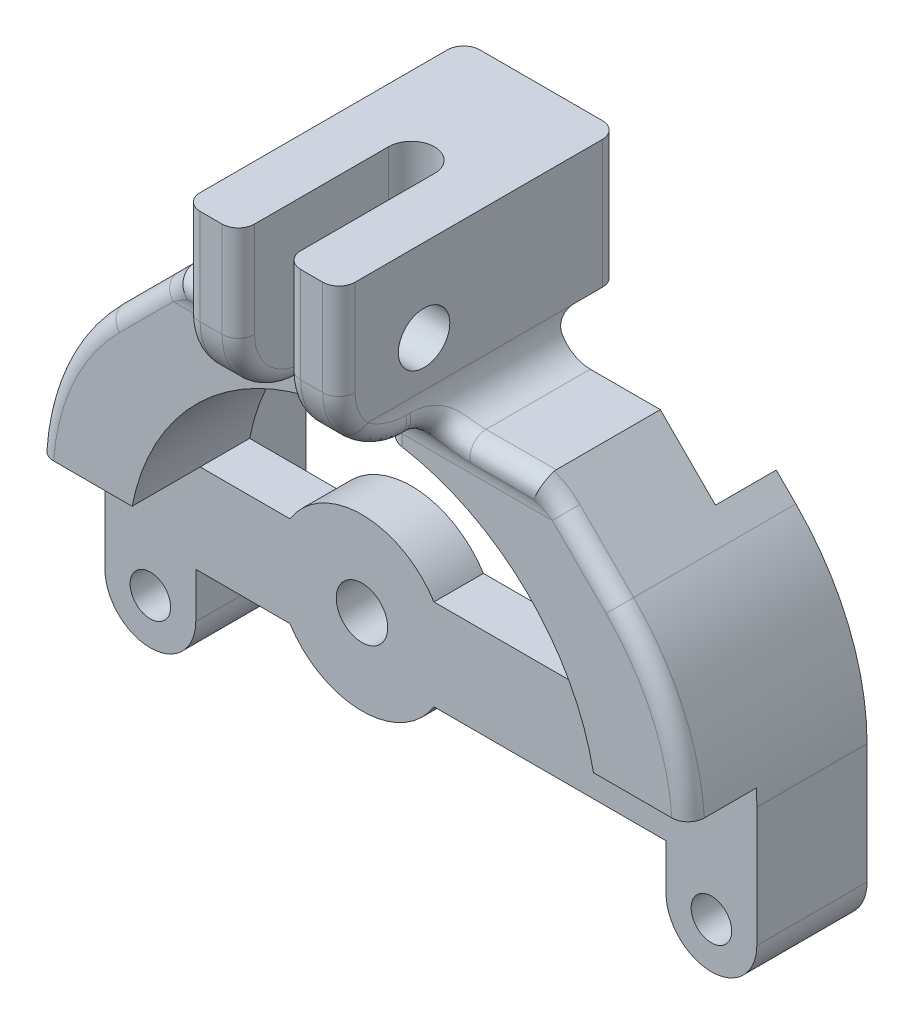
SolidWorks part; units mm, degrees
ref_plane "Front Plane" through (0, 0, 0) normal (0, 0, 1) x (1, 0, 0)
ref_plane "Top Plane" through (0, 0, 0) normal (0, 1, 0) x (1, 0, 0)
ref_plane "Right Plane" through (0, 0, 0) normal (1, 0, 0) x (0, 0, -1)
sketch "Sketch1" plane through (0, 0, 0) normal (0, 0, 1) x (1, 0, 0)
  line L0 (0, 0) -> (0, -52.1) construction
  line L1 (-17.3, 0) -> (17.3, 0) construction
  line L2 (-17.3, -9.6) -> (17.3, -9.6) construction
  line L3 (17.3, -9.6) -> (17.3, 0) construction
  line L4 (14.5, -9.6) -> (14.5, -4)
  line L5 (20.1, -9.6) -> (20.1, 13)
  line L6 (-17.3, -9.6) -> (-17.3, 0) construction
  line L7 (-20.1, -9.6) -> (-20.1, 13)
  line L8 (-14.5, -9.6) -> (-14.5, -4)
  line L9 (-17.3, 0) -> (-17.3, 9) construction
  line L10 (-20.1, 13) -> (20.1, 13)
  line L11 (-17.3, 9) -> (17.9065, 9) construction
  line L12 (3.3541, 9) -> (-3.3541, 9)
  line L13 (0, -4) -> (0, 21) construction
  circle A1 centre (17.3, -9.6) radius 1.25
  arc A2 (14.5, -9.6) -> (20.1, -9.6) centre (17.3, -9.6) ccw
  arc A3 (14.5, -4) -> (10.8077, 5.6667) centre (0, -4) ccw
  arc A4 (-10.8077, 5.6667) -> (-14.5, -4) centre (0, -4) ccw
  arc A5 (-14.5, -9.6) -> (-20.1, -9.6) centre (-17.3, -9.6) cw
  circle A6 centre (-17.3, -9.6) radius 1.25
  arc A8 (-3.3541, 9) -> (-10.8077, 5.6667) centre (-3.3541, -1) ccw
  arc A9 (3.3541, 9) -> (10.8077, 5.6667) centre (3.3541, -1) cw
  point P16 (0, -9.6)
  point P20 (0, -4)
  point P28 (-6.4226, 9)
  point P31 (6.4226, 9)
  dimension "D4" = 2.5
  dimension "D6" = 10
  dimension "D1" = 17.3
  dimension "D3" = 9.6
  dimension "D5" = 2.8
  dimension "D7" = 4
  dimension "D8" = 9
  dimension "D9" = 4
  dimension "D10" = 48.1
  dimension "D11" = 25
extrude "Body" add sketch "Sketch1" along normal mid plane 11
sketch "Sketch6" plane through (0, 13, 0) normal (0, 1, 0) x (1, 0, 0)
  line L0 (-17.8, -2.5) -> (17.8, -2.5) construction
  line L1 (-1.2, -2.5) -> (-1.2, -5.5)
  line L2 (-20.1, -5.5) -> (20.1, -5.5) construction
  line L3 (-20.1, 5.5) -> (20.1, 5.5) construction
  line L4 (-1.2, -5.5) -> (1.2, -5.5)
  line L5 (1.2, -5.5) -> (1.2, -2.5)
  line L6 (0, 0) -> (0, -2.5) construction
  arc A0 (1.2, -2.5) -> (-1.2, -2.5) centre (0, -2.5) ccw
  dimension "D1" = 2.4
  dimension "D2" = 8
extrude "Pulley Clearance" cut sketch "Sketch6" against normal through all
sketch "Sketch17" plane through (0, 13, 0) normal (0, 1, 0) x (1, 0, 0)
  line L0 (1.2, 5.5) -> (1.2, -11.75)
  line L1 (-20.1, 5.5) -> (20.1, 5.5) construction
  line L2 (4.78, 5.5) -> (4.78, -11.75)
  line L3 (1.2, -11.75) -> (4.78, -11.75)
  line L4 (1.2, -5.5) -> (20.1, -5.5) construction
  line L5 (1.2, -5.5) -> (1.2, -2.5) construction
  line L6 (-1.2, -11.75) -> (-4.78, -11.75)
  line L7 (-4.78, 5.5) -> (-4.78, -11.75)
  line L8 (-1.2, 5.5) -> (-1.2, -11.75)
  line L9 (-4.78, 5.5) -> (-1.2, 5.5)
  line L10 (1.2, 5.5) -> (4.78, 5.5)
  line L11 (0, 5.5) -> (0, -1.3) construction
  arc A0 (1.2, -2.5) -> (-1.2, -2.5) centre (0, -2.5) ccw construction
  point P2 (0, 0)
  dimension "D1" = 6.25
  dimension "D2" = 4.78
extrude "Pulley Block" add sketch "Sketch17" along normal blind 9.9
sketch "Sketch18" plane through (-4.78, 0, 0) normal (-1, 0, 0) x (0, 0, 1)
  line L2 (-5.5, 13) -> (5.5, 13) construction
  line L3 (-5.5, 22.9) -> (-5.5, 13) construction
  line L4 (5.5, 13) -> (11.75, 13) construction
  circle A0 centre (6.5, 17.8) radius 1.5875
  point P0 (6.5, 17.8)
  point P1 (2.5, 17.8)
  dimension "D5" = 3.175
  dimension "D1" = 8
  dimension "D2" = 4
  dimension "D3" = 4.8
  dimension "D4" = 4.8
extrude "Pulley Pin" cut sketch "Sketch18" against normal through all
sketch "Sketch19" plane through (0, 0, 5.5) normal (0, 0, 1) x (1, 0, 0)
  line L0 (0, 0) -> (0, -4) construction
  line L1 (-14.5, -4) -> (-14.5, -15.8685)
  line L2 (-14.5, -15.8685) -> (14.5, -15.8685)
  line L3 (14.5, -15.8685) -> (14.5, -4)
  arc A0 (14.5, -4) -> (-14.5, -4) centre (0, -4) ccw
  dimension "D1" = 4
extrude "Front Clearance" cut sketch "Sketch19" against normal blind 7.5
sketch "Sketch25" plane through (0, 13, 0) normal (0, 1, 0) x (1, 0, 0)
  line L2 (-1.2, -2.5) -> (-1.2, 5.5) construction
  line L4 (1.2, 5.5) -> (1.2, -2.5) construction
  line L5 (-1.2, -2.5) -> (-1.2, 5.5)
  line L6 (1.2, 5.5) -> (-1.2, 5.5)
  line L8 (4.78, 5.5) -> (1.2, 5.5) construction
  line L9 (1.2, 5.5) -> (1.2, -2.5)
  arc A1 (1.2, -2.5) -> (-1.2, -2.5) centre (0, -2.5) ccw construction
  arc A2 (1.2, -2.5) -> (-1.2, -2.5) centre (0, -2.5) ccw
extrude "Pulley Block Support" add sketch "Sketch25" along normal up to surface (9.9 mm away)
sketch "Sketch28" plane through (0, 0, -5.5) normal (0, 0, -1) x (-1, 0, 0)
  line L0 (0, 0) -> (0, 22.9) construction
  line L1 (-4.78, 22.9) -> (4.78, 22.9) construction
  line L2 (-4.78, 13) -> (-20.1, 13) construction
  line L3 (-14.5, 15) -> (14.5, 15)
  line L4 (-14.5, 15) -> (-14.5, -4)
  line L5 (-14.5, -4) -> (14.5, -4)
  line L6 (14.5, 15) -> (14.5, -4)
  dimension "D1" = 2
extrude "Servo Clearance" cut sketch "Sketch28" against normal blind 3.75
sketch "Sketch27" plane through (0, 0, 5.5) normal (0, 0, 1) x (1, 0, 0)
  line L0 (-14.5, -4) -> (14.5, -4) construction
  line L1 (0, -4) -> (0, -13.1864) construction
  line L3 (-14.5, -9.6) -> (-14.5, -4) construction
  line L4 (-14.5, -6.8) -> (14.5, -6.8)
  line L5 (-14.5, -6.8) -> (-14.5, -1.2)
  line L6 (-14.5, -1.2) -> (14.5, -1.2)
  line L7 (14.5, -6.8) -> (14.5, -1.2)
  circle A0 centre (-4.25, -4) radius 1.5875
  point P4 (0, -4)
  point P5 (-4.25, -4)
  dimension "D2" = 3.175
  dimension "D1" = 4.25
extrude "Reroute Block" add sketch "Sketch27" against normal up to surface (7.25 mm away)
sketch "Sketch29" plane through (0, 0, 5.5) normal (0, 0, 1) x (1, 0, 0)
  line L0 (-14.2271, -1.2) -> (-20.1, -1.2) construction
  line L1 (-20.1, -9.6) -> (-20.1, 13) construction
  line L2 (17.3, -12.4) -> (20.1, -12.4) construction
  line L3 (20.1, -12.4) -> (20.1, -9.6) construction
  line L5 (-20.1, -1.2) -> (20.1, -1.2)
  line L6 (-20.1, -1.2) -> (-20.1, -12.4)
  line L7 (-20.1, -12.4) -> (20.1, -12.4)
  line L8 (20.1, -1.2) -> (20.1, -12.4)
  arc A0 (14.5, -9.6) -> (20.1, -9.6) centre (17.3, -9.6) ccw construction
extrude "Reroute Clearance" cut sketch "Sketch29" against normal blind 4.2
sketch "Sketch30" plane through (0, 0, 1.3) normal (0, 0, 1) x (1, 0, 0)
  circle A0 centre (-4.25, -4) radius 5.25
  circle A1 centre (-4.25, -4) radius 1.5875
  circle A2 centre (-4.25, -4) radius 1.5875 construction
  dimension "D1" = 10.5
extrude "Reroute Pulley Block" add sketch "Sketch30" against normal up to surface (3.05 mm away)
sketch "Sketch32" plane through (0, 22.9, 0) normal (0, 1, 0) x (1, 0, 0)
  line L0 (1.2, -2.5) -> (1.2, -11.75) construction
  line L1 (-1.2, -11.75) -> (-1.2, -2.5) construction
  line L2 (1.2, -2.5) -> (1.2, -11.75) construction
  line L3 (-1.2, -11.75) -> (-1.2, -2.5) construction
  line L4 (1.425, -11.75) -> (1.425, -2.5)
  line L5 (1.2, -11.75) -> (4.78, -11.75) construction
  line L6 (0, -2.5) -> (0, 0) construction
  line L7 (-1.425, -11.75) -> (-1.425, -2.5)
  line L8 (1.425, -11.75) -> (-1.425, -11.75)
  line L9 (1.425, -2.5) -> (0, -2.5) construction
  arc A0 (1.2, -2.5) -> (-1.2, -2.5) centre (0, -2.5) ccw construction
  arc A1 (1.2, -2.5) -> (-1.2, -2.5) centre (0, -2.5) ccw construction
  arc A2 (1.425, -2.5) -> (-1.425, -2.5) centre (0, -2.5) ccw
  dimension "D1" = 0.225
extrude "Print Pulley Clearance" cut sketch "Sketch32" against normal up to surface (12.4702 mm away)
chamfer "Chamfer1" distance 9 angle 45 2 edges at (20.1, 13, 0) (-20.1, 13, 0)
fillet "Fillet1" radius 15 2 edges at (20.1, 4, 0) (-20.1, 4, 0)
fillet "Fillet2" radius 4 2 edges at (3.1025, 13, 11.75) (-3.1025, 13, 11.75)
fillet "Fillet3" radius 2 4 edges at (-3.1025, 13, 5.5) (-4.78, 13, 1.875)
fillet "Fillet4" radius 1 29 edges at (6.78, 13, 7.625) (-6.78, 13, 7.625) (18.7563, 3.9921, 5.5) (14.4033, 9.6967, 5.5) (-18.7563, 3.9921, 5.5) (-14.4033, 9.6967, 5.5) (11.6858, 12.4142, 6.0858) (-11.6858, 12.4142, 6.0858) (8.94, 13, 7.5) (4.78, 19.95, 11.75) (4.78, 15.9647, 11.6137) (5.4348, 13.52, 9.7222) (-4.78, 15.9647, 11.6137) (-4.78, 19.95, 11.75) (-5.4348, 13.52, 9.7222) (-8.94, 13, 7.5) (0, 15, -1.75) (-4.78, 18.95, -5.5) (1.425, 19.95, 11.75) (1.425, 14.1716, 10.5784) (1.425, 13, 7.625) (1.425, 12.4142, 6.0858) (-1.425, 19.95, 11.75) (-1.425, 14.1716, 10.5784) (-1.425, 13, 7.625) (-1.425, 12.4142, 6.0858) (1.425, 10.7149, 5.5) (-1.425, 10.7149, 5.5)
ref_point "Ref Center"
equation "\"D1@Sketch6\"=\"pulley thickness@values@params.sldprt\""
equation "\"D5@Sketch18\"=\"pin diameter@values@params.sldprt\""
equation "\"D2@Sketch27\"=\"pin diameter@values@params.sldprt\""
equation "\"D1@Sketch32\"=\"print free@values@params.sldprt\"/2"
